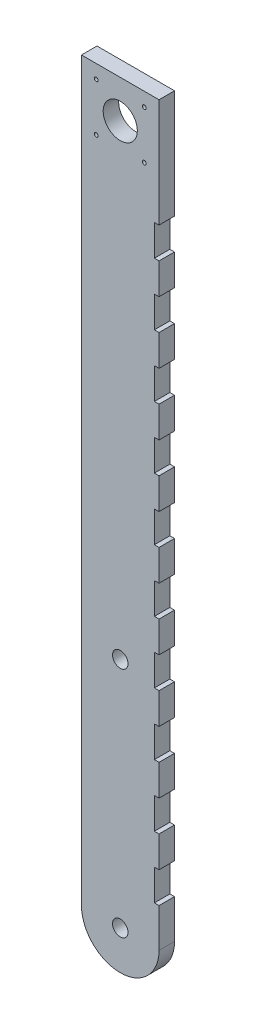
SolidWorks part; units mm, degrees
ref_plane "Front Plane" through (0, 0, 0) normal (0, 0, 1) x (1, 0, 0)
ref_plane "Top Plane" through (0, 0, 0) normal (0, 1, 0) x (1, 0, 0)
ref_plane "Right Plane" through (0, 0, 0) normal (1, 0, 0) x (0, 0, -1)
sketch "Sketch1" plane through (0, 0, 0) normal (0, 0, 1) x (1, 0, 0)
  line L0 (0, -1565.9861) -> (0, 76733.3209) construction
  line L1 (-25, 130) -> (25, 130)
  line L2 (-25, 130) -> (-25, -345)
  line L3 (39.6212, -320) -> (-39.6212, -320) construction
  line L4 (25, 130) -> (25, -280) construction
  line L5 (-25, 130) -> (32.4813, -168.9026) construction
  line L6 (-24.8303, -129.1176) -> (25, 130) construction
  line L7 (-1565.9861, 0) -> (76733.3209, 0) construction
  line L8 (-42.7696, 105.6639) -> (42.7696, 105.6639) construction
  line L9 (-21.1, 126.7639) -> (21.1, 126.7639) construction
  line L10 (-21.1, 126.7639) -> (-21.1, 84.5639) construction
  line L11 (-21.1, 84.5639) -> (21.1, 84.5639) construction
  line L12 (21.1, 126.7639) -> (21.1, 84.5639) construction
  line L13 (-21.1, 126.7639) -> (21.1, 84.5639) construction
  line L14 (-21.1, 84.5639) -> (21.1, 126.7639) construction
  line L15 (42.7696, 74.5639) -> (-42.7696, 74.5639) construction
  line L16 (22, -320) -> (22, -300)
  line L17 (22, -300) -> (25, -300)
  line L18 (25, -300) -> (25, -280)
  line L19 (25, -280) -> (22, -280)
  line L21 (25, -345) -> (25, -320)
  line L22 (25, -320) -> (22, -320)
  line L23 (22, -280) -> (22, -260)
  line L24 (22, -260) -> (25, -260)
  line L25 (25, -260) -> (25, -240)
  line L26 (25, -240) -> (22, -240)
  line L27 (22, -240) -> (22, -220)
  line L28 (22, -220) -> (25, -220)
  line L29 (25, -220) -> (25, -200)
  line L30 (25, -200) -> (22, -200)
  line L31 (22, -200) -> (22, -180)
  line L32 (22, -180) -> (25, -180)
  line L33 (25, -180) -> (25, -160)
  line L34 (25, -160) -> (22, -160)
  line L35 (22, -160) -> (22, -140)
  line L36 (22, -140) -> (25, -140)
  line L37 (25, -140) -> (25, -120)
  line L38 (25, -120) -> (22, -120)
  line L39 (22, -120) -> (22, -100)
  line L40 (22, -100) -> (25, -100)
  line L41 (25, -100) -> (25, -80)
  line L42 (25, -80) -> (22, -80)
  line L43 (22, -80) -> (22, -60)
  line L44 (22, -60) -> (25, -60)
  line L45 (25, -60) -> (25, -40)
  line L46 (25, -40) -> (22, -40)
  line L47 (22, -40) -> (22, -20)
  line L48 (22, -20) -> (25, -20)
  line L49 (25, -20) -> (25, 0)
  line L50 (25, 0) -> (22, 0)
  line L51 (22, 0) -> (22, 20)
  line L52 (22, 20) -> (25, 20)
  line L53 (25, 20) -> (25, 40)
  line L54 (25, 40) -> (22, 40)
  line L55 (22, 40) -> (22, 60)
  line L56 (22, 60) -> (25, 60)
  line L57 (25, 60) -> (25, 130)
  line L59 (25, 80) -> (22, 80)
  line L61 (25, 74.5639) -> (25, 80)
  circle A0 centre (-15.5, 121.1639) radius 1.25
  circle A1 centre (15.5, 121.1639) radius 1.25
  circle A2 centre (15.5, 90.1639) radius 1.25
  circle A3 centre (-15.5, 90.1639) radius 1.25
  circle A4 centre (0, 105.6639) radius 11
  circle A5 centre (0, -195) radius 5
  arc A6 (-25, -345) -> (25, -345) centre (0, -345) ccw
  circle A7 centre (0, -345) radius 25 construction
  circle A10 centre (0, -345) radius 5
  point P0 (0, 0)
  point P9 (0, 105.6639)
  point P20 (0, 105.6639)
  point P28 (0, 83.0234)
  point P38 (0, -320)
  point P40 (0, -370)
  point P43 (0, -345)
  point P44 (0, -247.5)
  point P45 (0, -347.5)
  point P46 (0, -107.5)
  point P47 (0, 74.5639)
  point P49 (0, -147.5)
  dimension "D4" = 2.5
  dimension "D6" = 22
  dimension "D9" = 3
  dimension "D10" = 20
  dimension "D12" = 10
  dimension "D7" = 10
  dimension "D1" = 50
  dimension "D2" = 500
  dimension "D3" = 42.2
  dimension "D5" = 31
  dimension "D8" = 150
  dimension "D13" = 8.8361
  dimension "D11" = 10
extrude "Boss-Extrude1" add sketch "Sketch1" along normal blind 10
sketch "Sketch2" plane through (0, 0, 10) normal (0, 0, 1) x (1, 0, 0)
  circle A0 centre (0, -345) radius 13
  circle A1 centre (0, -195) radius 13
  dimension "D1" = 26
  dimension "D2" = 26
